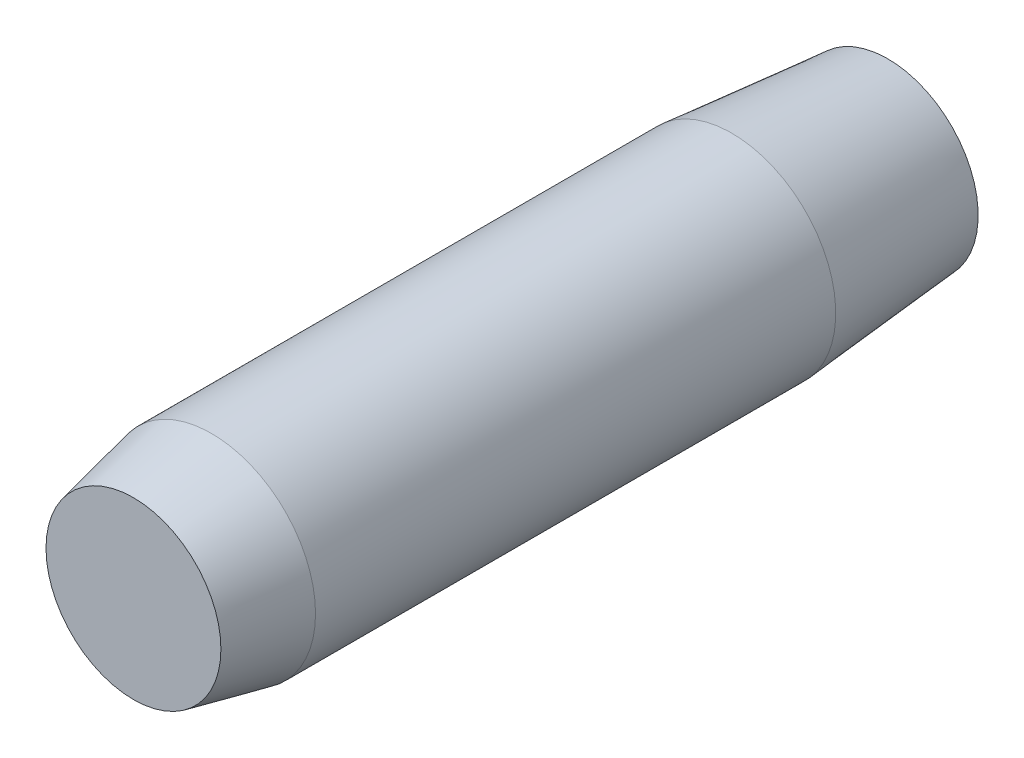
SolidWorks part; units mm, degrees
ref_plane "Face" through (0, 0, 0) normal (0, 0, 1) x (1, 0, 0)
ref_plane "Dessus" through (0, 0, 0) normal (0, 1, 0) x (1, 0, 0)
ref_plane "Droite" through (0, 0, 0) normal (1, 0, 0) x (0, 0, -1)
sketch "Esquisse1" plane through (0, 0, 0) normal (0, 0, 1) x (1, 0, 0)
  circle A0 centre (0, 0) radius 20
  dimension "D1" = 40
extrude "Extrusion1" add sketch "Esquisse1" along normal blind 100
sketch "Esquisse2" plane through (0, 0, 100) normal (0, 0, 1) x (1, 0, 0)
  circle A0 centre (0, 0) radius 20
  circle A1 centre (0, 0) radius 20 construction
extrude "Extrusion2" add sketch "Esquisse2" along normal blind 15 draft 12
sketch "Esquisse3" plane through (0, 0, 0) normal (0, 0, -1) x (-1, 0, 0)
  circle A0 centre (0, 0) radius 20
  circle A1 centre (0, 0) radius 20 construction
extrude "Extrusion3" add sketch "Esquisse3" along normal blind 30 draft 5
